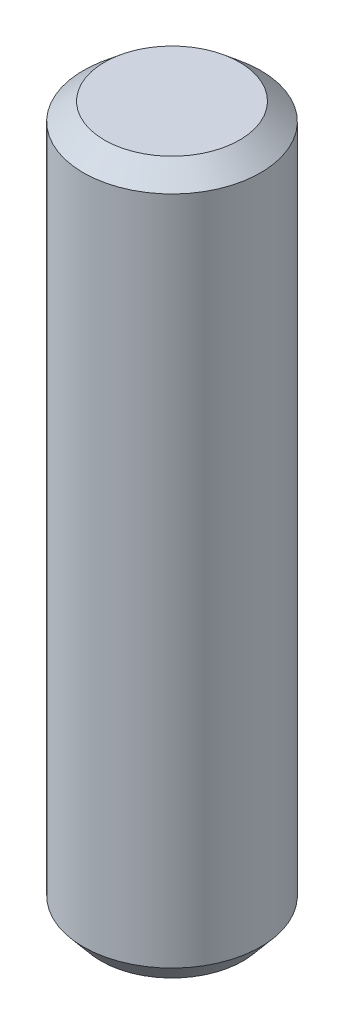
SolidWorks part; units mm, degrees
ref_plane "Front" through (0, 0, 0) normal (0, 0, 1) x (1, 0, 0)
ref_plane "Top" through (0, 0, 0) normal (0, 1, 0) x (1, 0, 0)
ref_plane "Right" through (0, 0, 0) normal (1, 0, 0) x (0, 0, -1)
sketch "Sketch1" plane through (0, 0, 0) normal (0, 1, 0) x (1, 0, 0)
  circle A0 centre (0, 0) radius 5
  dimension "D1" = 10
extrude "Boss-Extrude1" add sketch "Sketch1" along normal mid plane 40
chamfer "Chamfer1" distance 1 angle 50 2 edges at (0, -20, 5) (0, 20, 5)
